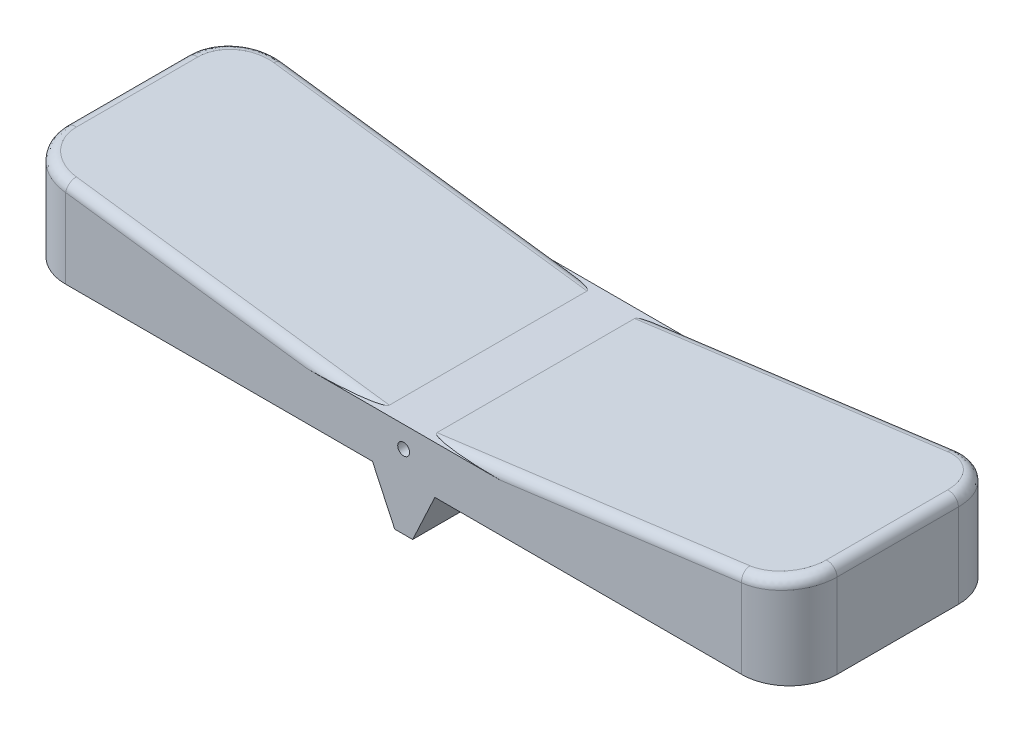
SolidWorks part; units mm, degrees
ref_plane "Planta" through (0, 0, 0) normal (0, 0, 1) x (1, 0, 0)
ref_plane "Perfil" through (0, 0, 0) normal (0, 1, 0) x (1, 0, 0)
ref_plane "Alzado" through (0, 0, 0) normal (1, 0, 0) x (0, 0, -1)
sketch "Croquis1" plane through (0, 0, 0) normal (0, 0, 1) x (1, 0, 0)
  line L0 (0, 0) -> (0, 20)
  line L1 (0, 20) -> (76, 10)
  line L2 (76, 10) -> (86, 10)
  line L3 (86, 10) -> (162, 20)
  line L4 (162, 20) -> (162, 0)
  line L5 (162, 0) -> (0, 0)
  line L7 (76, 10) -> (0, 10) construction
  circle A0 centre (81, 5.5) radius 1.25
  dimension "D7" = 2.5
  dimension "D1" = 162
  dimension "D2" = 20
  dimension "D3" = 10
  dimension "D4" = 20
  dimension "D5" = 10
  dimension "D6" = 76
  dimension "D8" = 4.5
extrude "Saliente-Extruir1" add sketch "Croquis1" along normal blind 45.5
fillet "Redondeo1" radius 10 4 edges at (0, 10, 45.5) (0, 10, 0) (162, 10, 45.5) (162, 10, 0)
sketch "Croquis2" plane through (0, 0, 0) normal (0, -1, 0) x (1, 0, 0)
  line L0 (81, 0) -> (81, 45.5) construction
  line L1 (10, 0) -> (152, 0) construction
  line L2 (10, 45.5) -> (152, 45.5) construction
  line L4 (82.8, 45.5) -> (79.2, 45.5)
  line L5 (82.8, 45.5) -> (82.8, 0)
  line L6 (82.8, 0) -> (79.2, 0)
  line L7 (79.2, 45.5) -> (79.2, 0)
  line L8 (82.8, 45.5) -> (79.2, 0) construction
  line L9 (82.8, 0) -> (79.2, 45.5) construction
  line L10 (81.3, 40.25) -> (80.7, 40.25)
  line L11 (81.3, 40.25) -> (81.3, 5.25)
  line L12 (81.3, 5.25) -> (80.7, 5.25)
  line L13 (80.7, 40.25) -> (80.7, 5.25)
  line L14 (81.3, 40.25) -> (80.7, 5.25) construction
  line L15 (81.3, 5.25) -> (80.7, 40.25) construction
  point P6 (81, 22.75)
  point P11 (81, 22.75)
  dimension "D1" = 35
  dimension "D2" = 0.6
  dimension "D3" = 1.5
extrude "Saliente-Extruir2" add sketch "Croquis2" along normal blind 10
chamfer "Chaflán1" distance 4.75 angle 65 2 edges at (82.8, 0, 22.75) (79.2, 0, 22.75)
sketch "Croquis3" plane through (0, 0, 0) normal (0, -1, 0) x (1, 0, 0)
  line L1 (81.3, 5.25) -> (80.7, 5.25)
  line L2 (81.3, 5.25) -> (81.3, 40.25)
  line L3 (81.3, 40.25) -> (80.7, 40.25)
  line L4 (80.7, 5.25) -> (80.7, 40.25)
extrude "Saliente-Extruir4" add sketch "Croquis3" along normal blind 1.125
fillet "Redondeo2" radius 2 10 edges at (43, 14.3421, 45.5) (2.9289, 19.6146, 42.5711) (0, 20, 22.75) (2.9289, 19.6146, 2.9289) (119, 14.3421, 45.5) (159.0711, 19.6146, 42.5711) (162, 20, 22.75) (119, 14.3421, 0) (43, 14.3421, 0) (159.0711, 19.6146, 2.9289)
